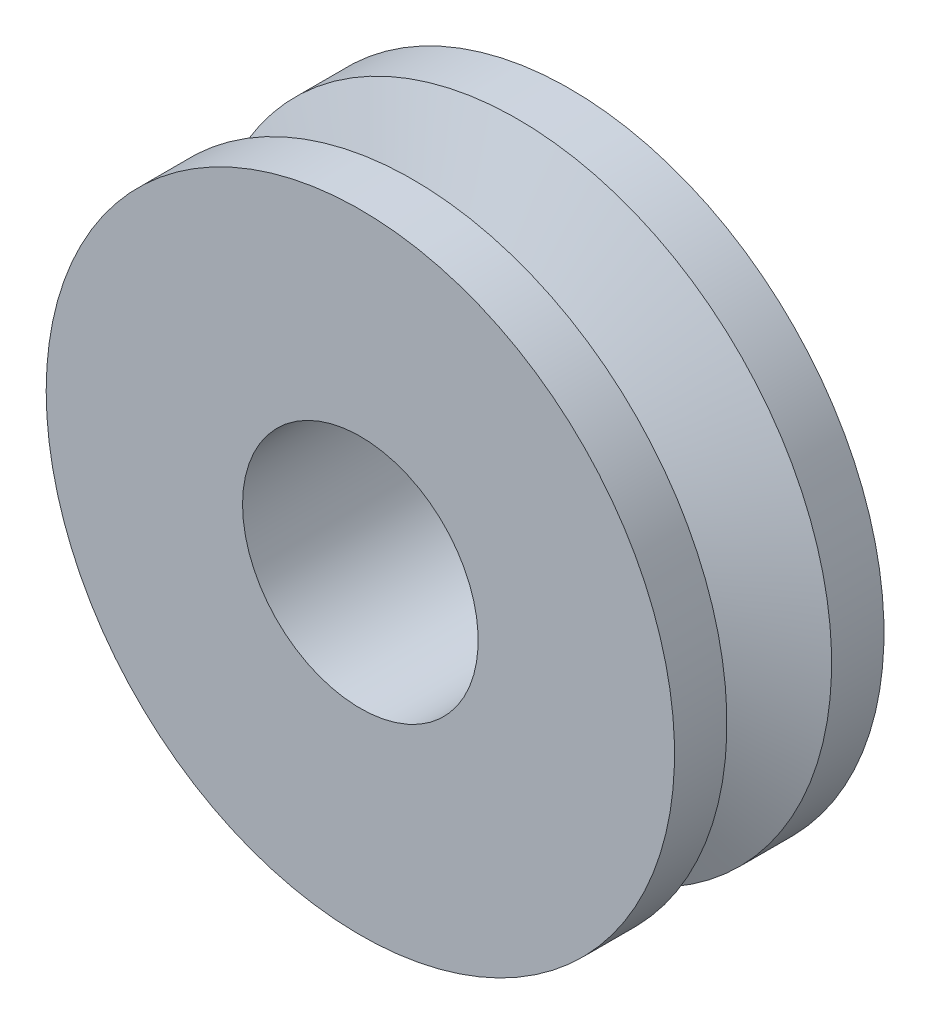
SolidWorks part; units mm, degrees
ref_plane "Front Plane" through (0, 0, 0) normal (0, 0, 1) x (1, 0, 0)
ref_plane "Top Plane" through (0, 0, 0) normal (0, 1, 0) x (1, 0, 0)
ref_plane "Right Plane" through (0, 0, 0) normal (1, 0, 0) x (0, 0, -1)
sketch "Sketch1" plane through (0, 0, 0) normal (0, 1, 0) x (1, 0, 0)
  line L0 (0, 0) -> (0, -10) construction
  line L1 (0, 0) -> (15, 0) construction
  line L2 (0, 0) -> (5.625, 0) construction
  line L3 (5.625, 0) -> (5.625, -10)
  line L4 (5.625, -10) -> (15, -10)
  line L5 (15, -10) -> (15, -7.5)
  line L6 (15, -7.5) -> (8.9645, -5)
  line L7 (8.9645, -5) -> (15, -2.5)
  line L8 (15, -2.5) -> (15, 0)
  line L9 (15, 0) -> (5.625, 0)
  point P3 (0, 0)
  point P11 (0, -5)
  point P12 (0, 0)
  point P13 (0, 0)
  dimension "D1" = 10
  dimension "D2" = 15
  dimension "D3" = 5.625
  dimension "D4" = 45
  dimension "D5" = 2.5
revolve "Revolve1" add sketch "Sketch1" angle 360 about L0
